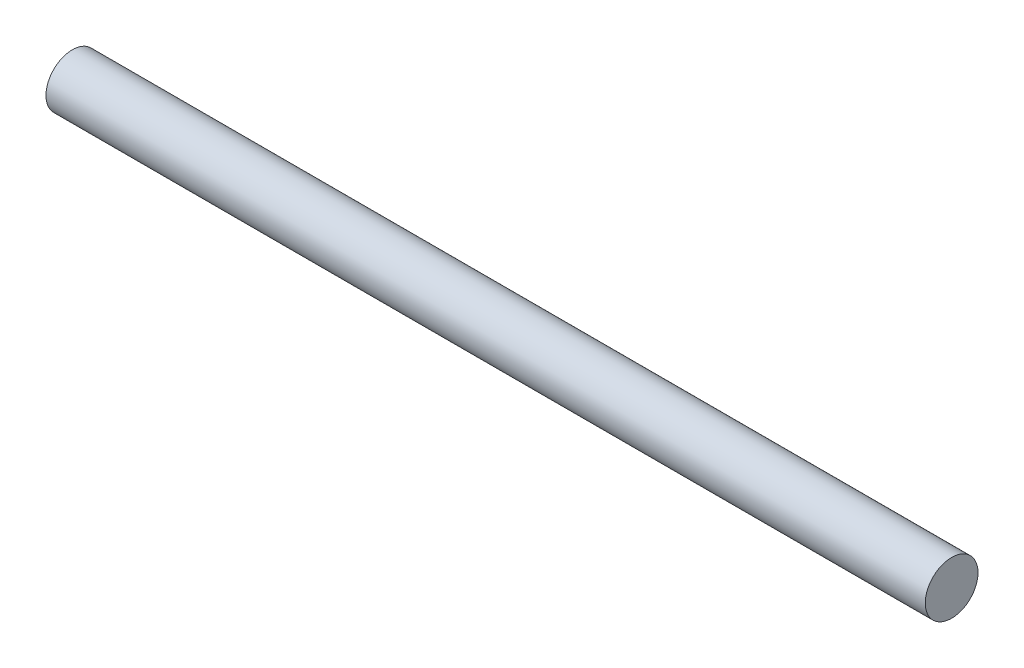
SolidWorks part; units mm, degrees
ref_plane "Front Plane" through (0, 0, 0) normal (0, 0, 1) x (1, 0, 0)
ref_plane "Top Plane" through (0, 0, 0) normal (0, 1, 0) x (1, 0, 0)
ref_plane "Right Plane" through (0, 0, 0) normal (1, 0, 0) x (0, 0, -1)
sketch "Sketch1" plane through (0, 0, 0) normal (1, 0, 0) x (0, 0, -1)
  circle A0 centre (0, 0) radius 7.5
extrude "Boss-Extrude1" add sketch "Sketch1" along normal mid plane 250
